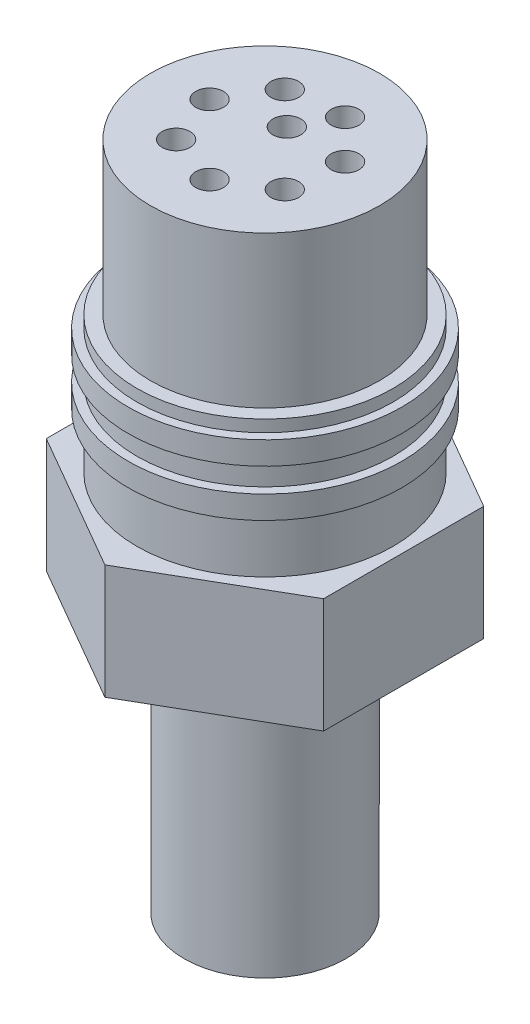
SolidWorks part; units mm, degrees
ref_plane "Front" through (0, 0, 0) normal (0, 0, 1) x (1, 0, 0)
ref_plane "Top" through (0, 0, 0) normal (0, 1, 0) x (1, 0, 0)
ref_plane "Right" through (0, 0, 0) normal (1, 0, 0) x (0, 0, -1)
sketch "Sketch1" plane through (0, 0, 0) normal (0, 1, 0) x (1, 0, 0)
  line L1 (0, 10.9985) -> (-9.525, 5.4993)
  line L2 (-9.525, 5.4993) -> (-9.525, -5.4993)
  line L3 (-9.525, -5.4993) -> (0, -10.9985)
  line L4 (0, -10.9985) -> (9.525, -5.4993)
  line L5 (9.525, -5.4993) -> (9.525, 5.4993)
  line L6 (9.525, 5.4993) -> (0, 10.9985)
  circle A0 centre (0, 0) radius 9.525 construction
  dimension "D1" = 19.05
extrude "Extrude1" add sketch "Sketch1" along normal blind 7.874
sketch "Sketch2" plane through (0, 0, 0) normal (0, 0, 1) x (1, 0, 0)
  line L0 (0, 0) -> (0, -1.8388) construction
  line L1 (8.8011, 7.874) -> (8.8011, 11.6586)
  line L2 (0, 7.874) -> (9.525, 7.874) construction
  line L3 (8.8011, 11.6586) -> (9.398, 11.6586)
  line L4 (9.398, 11.6586) -> (9.398, 13.2334)
  line L5 (9.398, 13.2334) -> (8.8011, 13.2334)
  line L6 (8.8011, 13.2334) -> (8.8011, 14.8844)
  line L7 (8.8011, 14.8844) -> (9.398, 14.8844)
  line L8 (9.398, 14.8844) -> (9.398, 16.4592)
  line L9 (9.398, 16.4592) -> (8.8011, 16.4592)
  line L10 (8.8011, 16.4592) -> (8.8011, 17.272)
  line L11 (8.8011, 17.272) -> (0, 17.272)
  line L12 (0, 17.272) -> (0, 7.874)
  line L13 (-9.398, 11.6586) -> (-9.398, 13.2334) construction
  line L14 (-8.8011, 7.874) -> (-8.8011, 11.6586) construction
  line L15 (8.8011, 7.874) -> (0, 7.874)
  dimension "D1" = 17.6022
  dimension "D2" = 18.796
  dimension "D3" = 1.5748
  dimension "D4" = 1.651
  dimension "D5" = 0.8128
  dimension "D6" = 9.398
revolve "Revolve1" add sketch "Sketch2" angle 360 about L0
sketch "Sketch3" plane through (0, 17.272, 0) normal (0, 1, 0) x (-1, 0, 0)
  circle A0 centre (0, 0) radius 7.875
  dimension "D1" = 15.75
extrude "Extrude2" add sketch "Sketch3" along normal blind 10.41
sketch "Sketch4" plane through (0, 27.682, 0) normal (0, 1, 0) x (-1, 0, 0)
  line L0 (0, 0) -> (3.0533, 3.0533) construction
  line L1 (0, 0) -> (0, 11.7626) construction
  circle A0 centre (3.0533, 3.0533) radius 0.955
  circle A1 centre (0, 0) radius 4.318 construction
  dimension "D1" = 1.91
  dimension "D2" = 8.636
  dimension "D3" = 45
extrude "Extrude8" cut sketch "Sketch4" against normal up to surface (10.41 mm away)
pattern_circular "CirPattern1" count 7 over 360 about axis through (0, 0, 0) along (0, 1, 0) of "Extrude8"
sketch "1" plane through (0.0995, 27.682, 4.4802) normal (0, 1, 0) x (-1, 0, 0)
  circle A0 centre (0.0995, -5.9802) radius 0.955
  dimension "D1" = 1.91
  dimension "D2" = 1.5
extrude "Extrude9" cut sketch "1" against normal up to surface (10.41 mm away)
sketch "Sketch8" plane through (0, 0, 0) normal (0, -1, 0) x (1, 0, 0)
  circle A0 centre (0, 0) radius 5.5562
  dimension "D1" = 11.1125
extrude "Extrude7" add sketch "Sketch8" along normal blind 18.2803
sketch "Sketch9" plane through (0, 0, 0) normal (0, 0, 1) x (1, 0, 0)
  line L0 (0, 0) -> (0, -1.4263) construction
  circle A0 centre (7.1, 0.2843) radius 0.89
  circle A1 centre (-7.1, 0.2843) radius 0.89 construction
  dimension "D1" = 1.78
  dimension "D2" = 12.42
revolve "o-ring 12.42x1.78" [suppressed] add sketch "Sketch9" angle 360 about L0
sketch "Sketch10" plane through (0, 0, 0) normal (0, 0, 1) x (1, 0, 0)
  line L0 (9.0805, 8.5119) -> (9.0805, 11.5824)
  line L1 (9.0805, 11.5824) -> (9.9445, 11.5824)
  line L2 (9.9445, 11.5824) -> (9.9445, 13.2334)
  line L3 (9.9445, 13.2334) -> (9.0805, 13.2334)
  line L4 (9.398, 13.2334) -> (-9.398, 13.2334) construction
  line L5 (9.0805, 13.2334) -> (9.0805, 14.7574)
  line L6 (9.0805, 14.7574) -> (9.9445, 14.7574)
  line L7 (9.9445, 14.7574) -> (9.9445, 19.0036)
  line L8 (9.9445, 19.0036) -> (7.9756, 19.0036)
  line L9 (7.9756, 19.0036) -> (7.9756, 49.6599)
  line L10 (9.0805, 8.5119) -> (11.049, 8.5119)
  line L11 (11.049, 8.5119) -> (11.049, 49.6599)
  line L12 (11.049, 49.6599) -> (7.9756, 49.6599)
  line L13 (0, 0) -> (0, 44.7429) construction
  line L14 (-11.049, 8.5119) -> (-11.049, 49.6599) construction
  line L15 (-9.9445, 11.5824) -> (-9.9445, 13.2334) construction
  line L16 (-9.0805, 8.5119) -> (-9.0805, 11.5824) construction
  line L17 (-7.9756, 19.0036) -> (-7.9756, 49.6599) construction
  dimension "D1" = 41.148
  dimension "D2" = 18.161
  dimension "D3" = 15.9512
  dimension "D4" = 1.651
  dimension "D5" = 1.524
  dimension "D6" = 22.098
  dimension "D7" = 3.0705
revolve "Locking Sleeve" [suppressed] add sketch "Sketch10" angle 360 about L13
